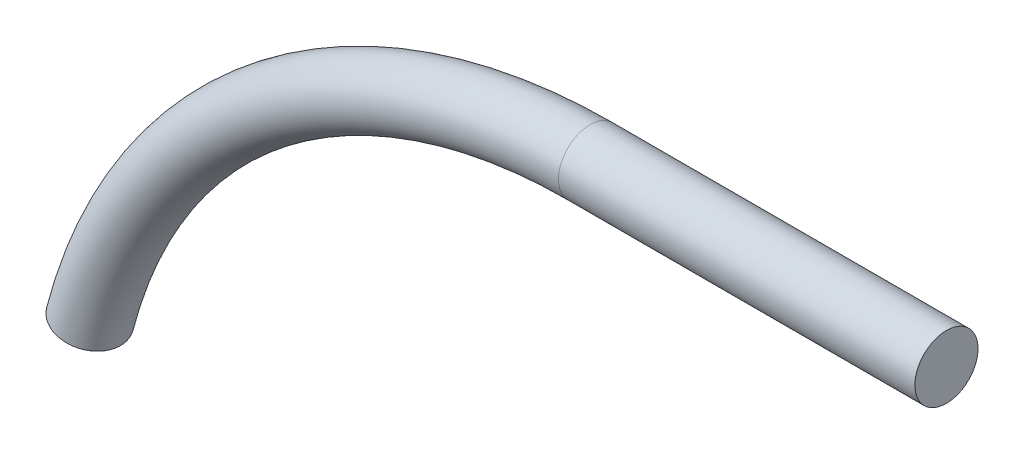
SolidWorks part; units mm, degrees
ref_plane "Vorne" through (0, 0, 0) normal (0, 0, 1) x (1, 0, 0)
ref_plane "Oben" through (0, 0, 0) normal (0, 1, 0) x (1, 0, 0)
ref_plane "Rechts" through (0, 0, 0) normal (1, 0, 0) x (0, 0, -1)
sketch "Skizze1" plane through (0, 0, 0) normal (0, 0, 1) x (1, 0, 0)
  line L0 (0, -68.5446) -> (0, 0) construction
  line L2 (0, 0) -> (-28.2072, 0)
  arc A0 (-28.2072, 0) -> (-67.7883, -30.5962) centre (-28.2072, -40.9003) ccw
  dimension "D1" = 28.2072
  dimension "D3" = 30.5962
  dimension "D2" = 40.9003
sketch "Skizze3" plane through (0, 0, 0) normal (1, 0, 0) x (0, 0, -1)
  circle A0 centre (0, 0) radius 2.5
  dimension "D1" = 5
sweep "Austragung1" add profiles "Skizze3" path "Skizze1"
